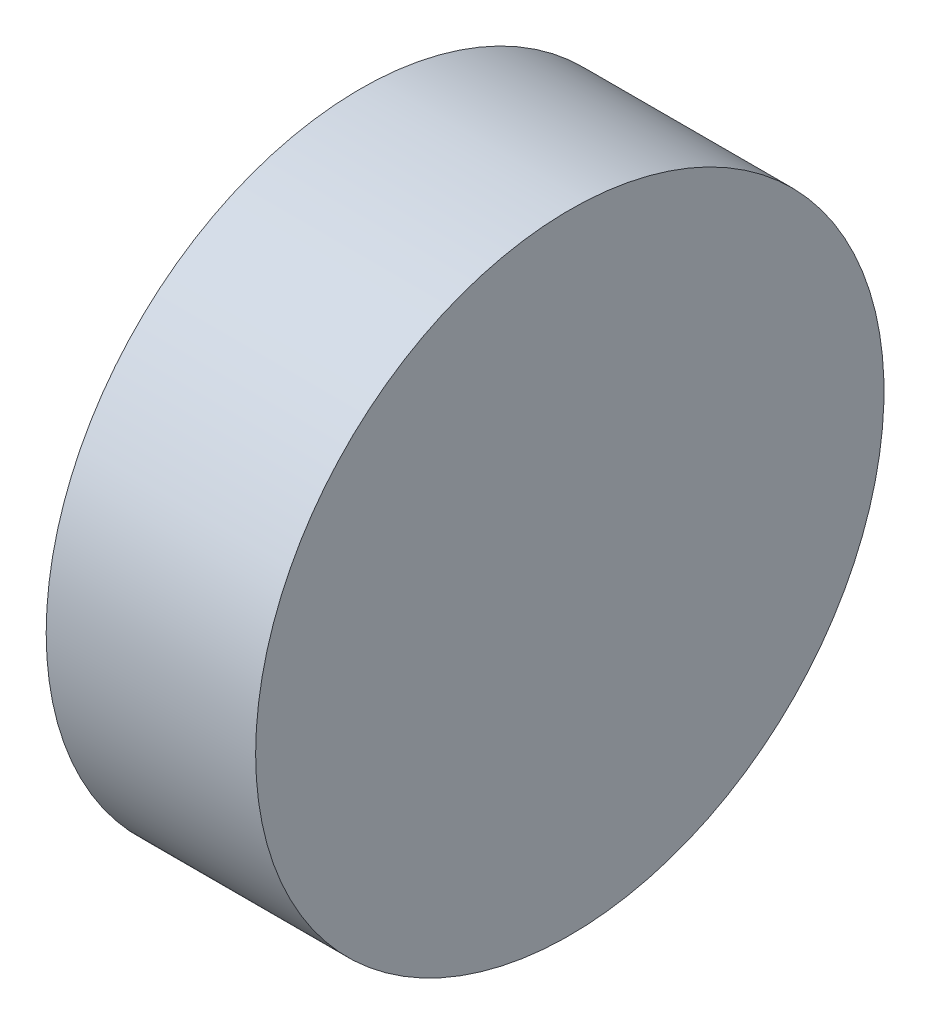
SolidWorks part; units mm, degrees
ref_plane "Plan de face" through (0, 0, 0) normal (0, 0, 1) x (1, 0, 0)
ref_plane "Plan de dessus" through (0, 0, 0) normal (0, 1, 0) x (1, 0, 0)
ref_plane "Plan de droite" through (0, 0, 0) normal (1, 0, 0) x (0, 0, -1)
sketch "Esquisse1" plane through (0, 0, 0) normal (0, 0, 1) x (1, 0, 0)
  line L0 (0, 0) -> (99.3272, 0) construction
sketch "Esquisse2" plane through (0, 0, 0) normal (1, 0, 0) x (0, 0, -1)
  circle A0 centre (0, 0) radius 150
  point P3 (150, 0)
  point P4 (-150, 0)
  dimension "D1" = 300
extrude "Extrusion1" add sketch "Esquisse2" along normal blind 100
